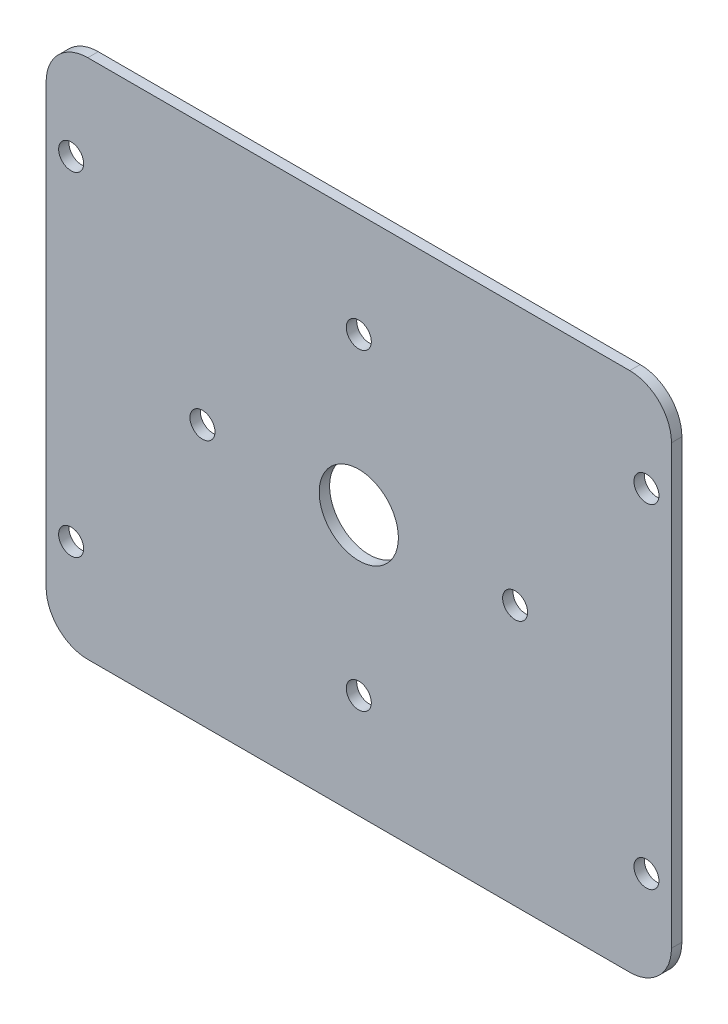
SolidWorks part; units mm, degrees
ref_plane "Face" through (0, 0, 0) normal (0, 0, 1) x (1, 0, 0)
ref_plane "Dessus" through (0, 0, 0) normal (0, 1, 0) x (1, 0, 0)
ref_plane "Droite" through (0, 0, 0) normal (1, 0, 0) x (0, 0, -1)
sketch "Esquisse1" plane through (0, 0, 0) normal (0, 0, 1) x (1, 0, 0)
  line L1 (0, 0) -> (300, 0)
  line L2 (0, 0) -> (0, 250)
  line L3 (0, 250) -> (300, 250)
  line L4 (300, 0) -> (300, 250)
  dimension "D1" = 300
  dimension "D2" = 250
extrude "Extrusion1" add sketch "Esquisse1" along normal blind 5
sketch "Esquisse2" plane through (0, 0, 5) normal (0, 0, 1) x (1, 0, 0)
  line L0 (300, 0) -> (300, 250) construction
  line L1 (0, 0) -> (300, 0) construction
  circle A0 centre (150, 125) radius 19
  dimension "D3" = 38
  dimension "D1" = 150
  dimension "D2" = 125
extrude "Enlèv. mat.-Extru.1" cut sketch "Esquisse2" against normal through all
fillet "Congé1" radius 20 4 edges at (0, 0, 2.5) (300, 0, 2.5) (300, 250, 2.5) (0, 250, 2.5)
sketch "Esquisse3" plane through (0, 0, 5) normal (0, 0, 1) x (1, 0, 0)
  line L0 (0, 230) -> (0, 20) construction
  line L1 (308.0576, 125) -> (-20.8367, 125) construction
  line L2 (12, 259.1431) -> (12, -6.8644) construction
  line L3 (150, 125) -> (150, 255.4816) construction
  circle A0 centre (12, 205) radius 6
  circle A1 centre (12, 45) radius 6
  circle A2 centre (288, 45) radius 6
  circle A3 centre (288, 205) radius 6
  dimension "D1" = 12
  dimension "D2" = 12
  dimension "D3" = 80
extrude "Enlèv. mat.-Extru.2" cut sketch "Esquisse3" against normal through all
sketch "Esquisse4" plane through (0, 0, 0) normal (0, 0, -1) x (-1, 0, 0)
  circle A0 centre (-225, 125) radius 6 construction
  circle A1 centre (-150, 50) radius 6 construction
  circle A2 centre (-75, 125) radius 6 construction
  circle A3 centre (-150, 200) radius 6 construction
  circle A4 centre (-225, 125) radius 6
  circle A5 centre (-150, 50) radius 6
  circle A6 centre (-75, 125) radius 6
  circle A7 centre (-150, 200) radius 6
extrude "Enlèv. mat.-Extru.3" cut sketch "Esquisse4" against normal through all
